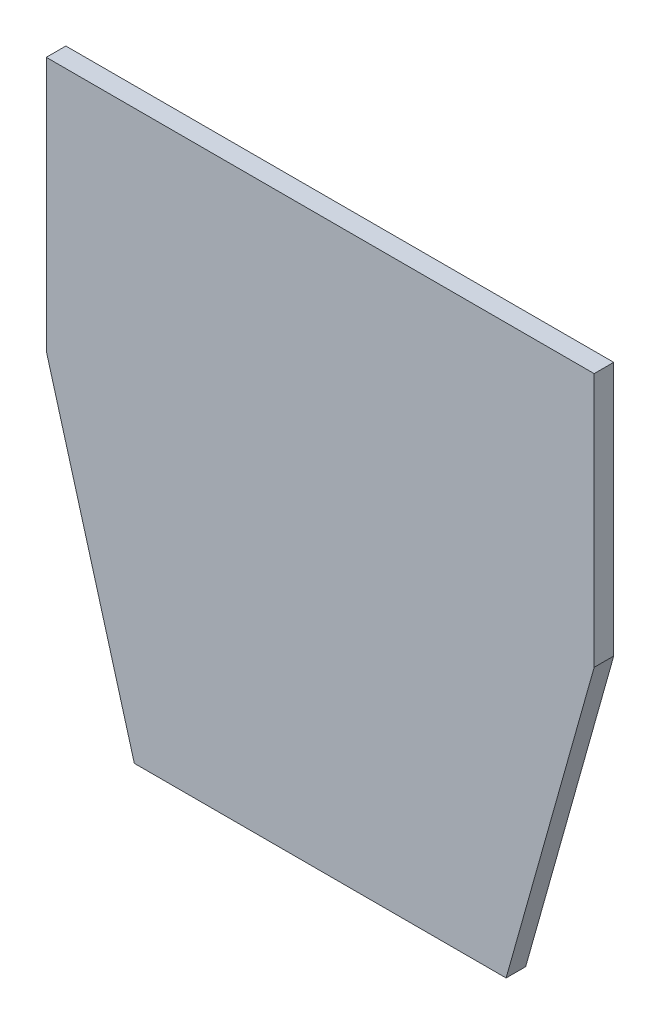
SolidWorks part; units mm, degrees
ref_plane "Plan de face" through (0, 0, 0) normal (0, 0, 1) x (1, 0, 0)
ref_plane "Plan de dessus" through (0, 0, 0) normal (0, 1, 0) x (1, 0, 0)
ref_plane "Plan de droite" through (0, 0, 0) normal (1, 0, 0) x (0, 0, -1)
sketch "Esquisse1" plane through (0, 0, 0) normal (0, 0, 1) x (1, 0, 0)
  line L0 (-95, 0) -> (95, 0)
  line L1 (95, 0) -> (140, 160)
  line L2 (140, 160) -> (140, 290)
  line L3 (140, 290) -> (-140, 290)
  line L4 (0, 290) -> (0, 0) construction
  line L5 (-140, 160) -> (-140, 290)
  line L6 (-95, 0) -> (-140, 160)
  dimension "D1" = 95
  dimension "D2" = 140
  dimension "D3" = 130
  dimension "D4" = 290
extrude "Boss.-Extru.1" add sketch "Esquisse1" along normal blind 10
